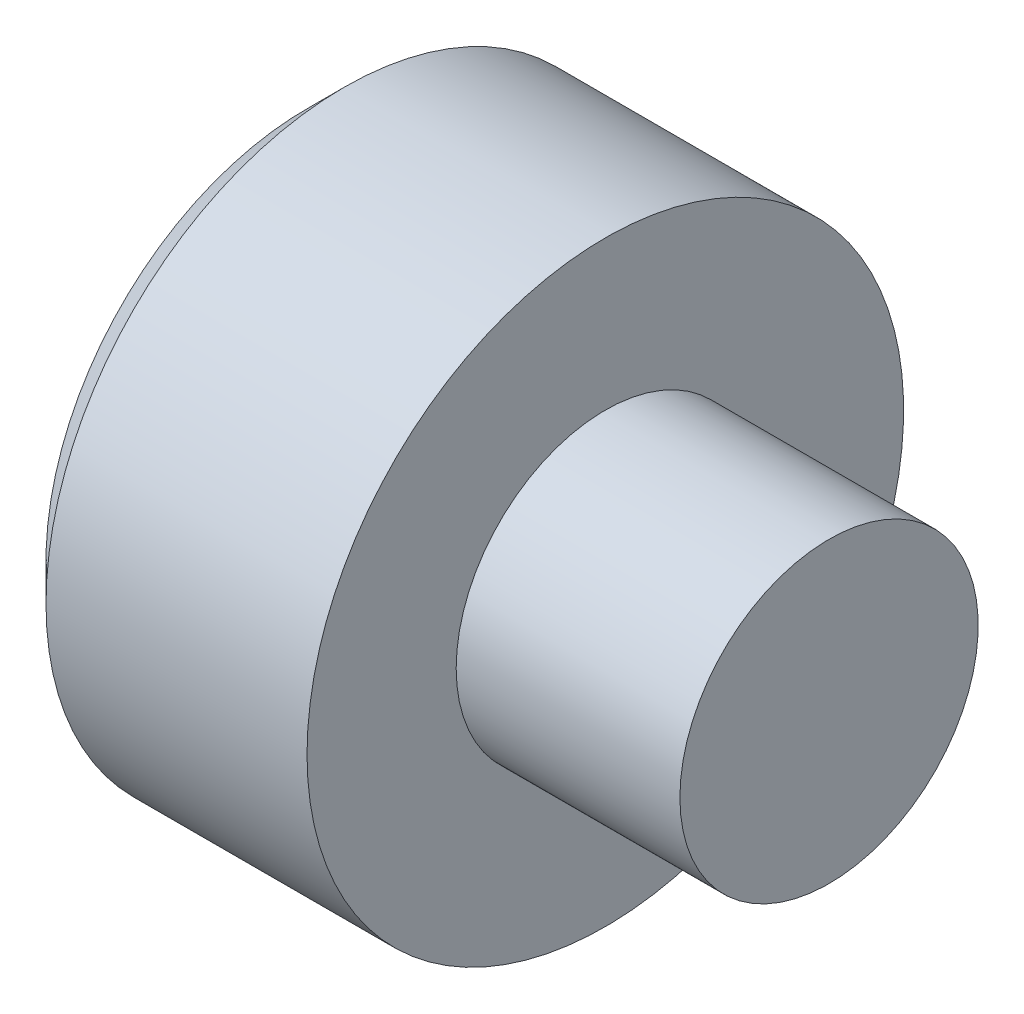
SolidWorks part; units mm, degrees
ref_plane "Face" through (0, 0, 0) normal (0, 0, 1) x (1, 0, 0)
ref_plane "Dessus" through (0, 0, 0) normal (0, 1, 0) x (1, 0, 0)
ref_plane "Droite" through (0, 0, 0) normal (1, 0, 0) x (0, 0, -1)
sketch "Esquisse1" plane through (0, 0, 0) normal (0, 0, 1) x (1, 0, 0)
  line L0 (-17.1561, 0) -> (83.5184, 0) construction
  line L1 (0, 0) -> (0, 4)
  line L2 (0, 4) -> (4, 4)
  line L3 (4, 4) -> (4, 2)
  line L4 (4, 2) -> (7, 2)
  line L5 (7, 2) -> (7, 0)
  line L6 (7, 0) -> (0, 0)
  dimension "D1" = 4
  dimension "D2" = 2
  dimension "D3" = 4
  dimension "D4" = 3
revolve "Base-Révolution" add sketch "Esquisse1" angle 360 about L0
chamfer "Chanfrein1" distance 0.5 angle 45
